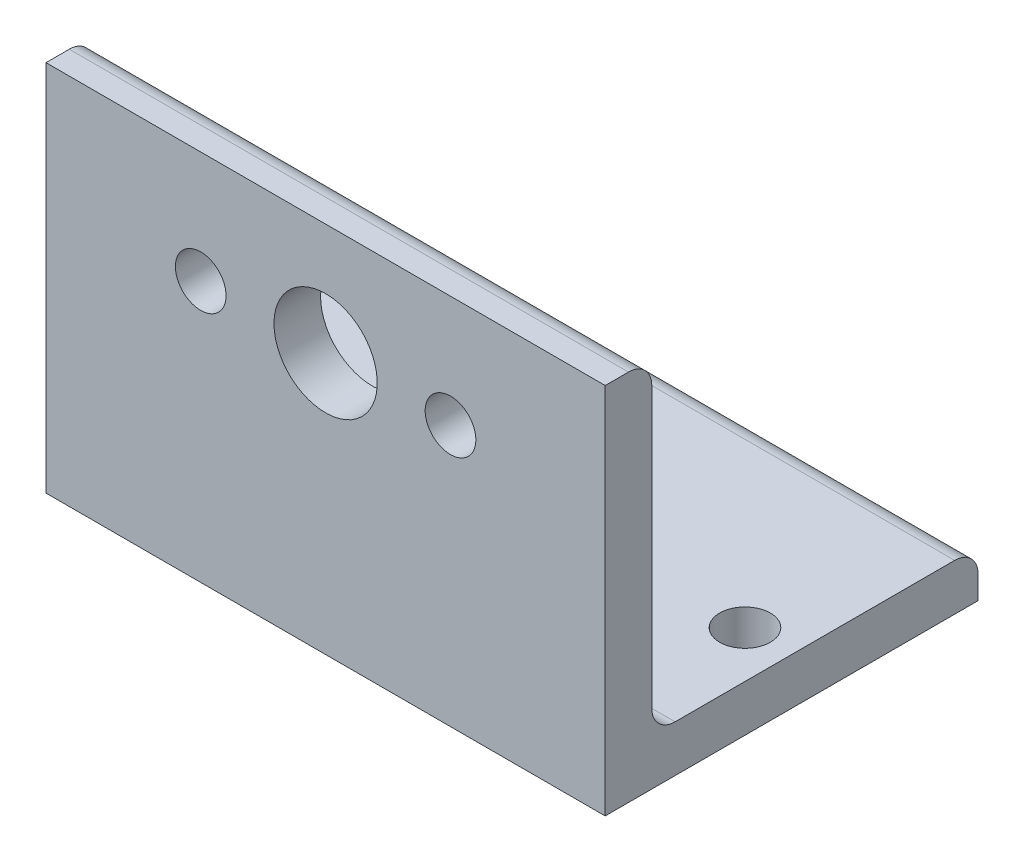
SolidWorks part; units mm, degrees
ref_plane "Front Plane" through (0, 0, 0) normal (0, 0, 1) x (1, 0, 0)
ref_plane "Top Plane" through (0, 0, 0) normal (0, 1, 0) x (1, 0, 0)
ref_plane "Right Plane" through (0, 0, 0) normal (1, 0, 0) x (0, 0, -1)
sketch "Sketch2" plane through (0, 0, 0) normal (1, 0, 0) x (0, 0, -1)
  line L0 (0, 0) -> (25.4, 0)
  line L1 (25.4, 0) -> (25.4, 3.175)
  line L2 (25.4, 3.175) -> (3.175, 3.175)
  line L3 (3.175, 3.175) -> (3.175, 25.4)
  line L4 (3.175, 25.4) -> (0, 25.4)
  line L5 (0, 25.4) -> (0, 0)
  dimension "D1" = 3.175
  dimension "D3" = 25.4
extrude "Boss-Extrude1" add sketch "Sketch2" along normal blind 38.1
sketch "Sketch3" plane through (0, 0, -3.175) normal (0, 0, -1) x (-1, 0, 0)
  line L0 (-38.1, 3.175) -> (0, 3.175) construction
  line L1 (0, 3.175) -> (0, 25.4) construction
  line L2 (-10.541, 17.78) -> (-19.05, 17.78) construction
  line L3 (-27.559, 17.78) -> (-19.05, 17.78) construction
  circle A0 centre (-19.05, 17.78) radius 3.5179
  circle A1 centre (-10.541, 17.78) radius 1.7272
  circle A2 centre (-27.559, 17.78) radius 1.7272
  dimension "D1" = 8.509
  dimension "D4" = 3.4544
  dimension "D6" = 7.0358
  dimension "D5" = 14.605
  dimension "D7" = 19.05
extrude "Cut-Extrude1" cut sketch "Sketch3" against normal through all
sketch "Sketch4" plane through (0, 3.175, 0) normal (0, 1, 0) x (1, 0, 0)
  line L0 (0, 25.4) -> (0, 3.175) construction
  line L1 (38.1, 25.4) -> (38.1, 3.175) construction
  line L2 (38.1, 25.4) -> (0, 25.4) construction
  line L3 (3.175, 12.7) -> (34.925, 12.7) construction
  circle A1 centre (3.175, 12.7) radius 1.7272
  circle A2 centre (34.925, 12.7) radius 1.7272
  dimension "D1" = 3.175
  dimension "D3" = 3.175
  dimension "D2" = 3.4544
  dimension "D6" = 12.7
extrude "Cut-Extrude2" cut sketch "Sketch4" against normal through all
fillet "Fillet1" radius 1.5875 3 edges at (19.05, 3.175, -25.4) (19.05, 3.175, -3.175) (19.05, 25.4, -3.175)
